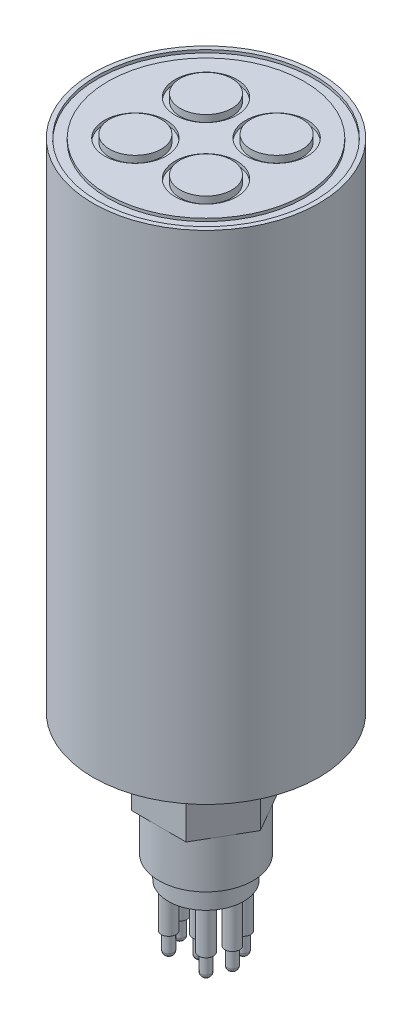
SolidWorks part; units mm, degrees
ref_plane "Front" through (0, 0, 0) normal (0, 0, 1) x (1, 0, 0)
ref_plane "Top" through (0, 0, 0) normal (0, 1, 0) x (1, 0, 0)
ref_plane "Right" through (0, 0, 0) normal (1, 0, 0) x (0, 0, -1)
sketch "Sketch1" plane through (0, 0, 0) normal (0, 1, 0) x (1, 0, 0)
  circle A0 centre (0, 0) radius 22.86
  dimension "D1" = 45.72
extrude "Boss-Extrude1" add sketch "Sketch1" along normal blind 100.584
sketch "Sketch2" plane through (0, 100.584, 0) normal (0, 1, 0) x (1, 0, 0)
  circle A0 centre (0, 0) radius 21.9456
  circle A2 centre (0, 0) radius 19.8628
extrude "Cut-Extrude1" cut sketch "Sketch2" against normal blind 0.5842
sketch "Sketch4" plane through (0, 100.584, 0) normal (0, 1, 0) x (1, 0, 0)
  line L0 (0, 0) -> (-16.4361, 0) construction
  line L1 (0, 0) -> (0, 17.578) construction
  circle A0 centre (-7.1437, 7.1437) radius 6.2547
  circle A1 centre (7.1437, 7.1437) radius 6.2547
  circle A2 centre (7.1437, -7.1437) radius 6.2547
  circle A3 centre (-7.1437, -7.1437) radius 6.2547
  dimension "D1" = 12.5095
  dimension "D3" = 13.3985
  dimension "D2" = 13.3985
extrude "Cut-Extrude4" cut sketch "Sketch4" against normal blind 0.7112
sketch "Sketch5" plane through (0, 99.8728, 0) normal (0, 1, 0) x (1, 0, 0)
  line L0 (0, 0) -> (0, 14.0298) construction
  line L1 (0, 0) -> (-15.5796, 0) construction
  circle A0 centre (-7.1437, 7.1437) radius 5.2324
  circle A1 centre (7.1437, 7.1437) radius 5.2324
  circle A2 centre (7.1437, -7.1437) radius 5.2324
  circle A3 centre (-7.1437, -7.1437) radius 5.2324
  dimension "D1" = 10.4648
extrude "Boss-Extrude2" add sketch "Sketch5" along normal blind 1.397
sketch "Sketch7" plane through (0, 0, 0) normal (0, -1, 0) x (1, 0, 0)
  line L1 (5.4993, 9.525) -> (-5.4993, 9.525)
  line L2 (-5.4993, 9.525) -> (-10.9985, 0)
  line L3 (-10.9985, 0) -> (-5.4993, -9.525)
  line L4 (-5.4993, -9.525) -> (5.4993, -9.525)
  line L5 (5.4993, -9.525) -> (10.9985, 0)
  line L6 (10.9985, 0) -> (5.4993, 9.525)
  circle A0 centre (0, 0) radius 9.525 construction
  dimension "D1" = 19.05
extrude "Boss-Extrude3" add sketch "Sketch7" along normal blind 15.24
sketch "Sketch8" plane through (0, -15.24, 0) normal (0, -1, 0) x (1, 0, 0)
  circle A0 centre (0, 0) radius 9.525
  dimension "D1" = 19.05
extrude "Boss-Extrude4" add sketch "Sketch8" along normal blind 9.525
sketch "Sketch9" plane through (0, -24.765, 0) normal (0, -1, 0) x (1, 0, 0)
  circle A0 centre (0, 0) radius 7.62
  dimension "D1" = 15.24
extrude "Boss-Extrude5" add sketch "Sketch9" along normal blind 4.572
sketch "Sketch10" plane through (0, -29.337, 0) normal (0, -1, 0) x (1, 0, 0)
  line L0 (0, 0) -> (3.7717, 3.7717) construction
  line L1 (0, 0) -> (0, 14.9678) construction
  circle A0 centre (3.7717, 3.7717) radius 1.4859
  dimension "D1" = 2.9718
  dimension "D2" = 5.334
  dimension "D3" = 45
extrude "Boss-Extrude6" add sketch "Sketch10" along normal blind 8.89
sketch "Sketch12" plane through (0, -38.227, 0) normal (0, -1, 0) x (1, 0, 0)
  circle A0 centre (3.7717, 3.7717) radius 1.016
  dimension "D1" = 2.032
extrude "Boss-Extrude7" add sketch "Sketch12" along normal blind 4.318
fillet "Fillet4" radius 0.9525 1 edges at (3.7717, -42.545, 2.7557)
pattern_circular "CirPattern1" count 7 every 45 about axis through (0, 0, 0) along (0, 1, 0) of "Boss-Extrude6", "Boss-Extrude7", "Fillet4"
pattern_linear "LPattern2" count 2 spacing 3.7719 along (-1, 0, 0) count 2 spacing 2.54 along (0, 0, -1) of "Boss-Extrude7", "Fillet4", "Boss-Extrude6"
ref_plane "Plane1" through (0, 0, -22.86) normal (0, 0, -1) x (-1, 0, 0)
hole_wizard "#6-32 Tapped Hole1" positions "3DSketch4" profile "Sketch16" tap size "#6-32" standard "ANSI Inch"
sketch3d "3DSketch4"
  circle A1 centre (0, 100.584, 0) radius 22.86 construction
  point P0 (0, 76.7567, -22.86)
  point P12 (0, 123.444, 0)
  dimension "D1" = 33.02
sketch "Sketch16" plane through (0, 76.7567, -22.86) normal (1, 0, 0) x (0, 1, 0)
  line L0 (0, 0) -> (0, 10.2107)
  line L1 (0, 10.2107) -> (1.3525, 9.398)
  line L2 (1.3525, 9.398) -> (1.3525, 7.112)
  line L3 (1.3525, 7.112) -> (1.7526, 7.112)
  line L4 (1.7526, 7.112) -> (1.7526, 0)
  line L5 (1.7526, 0) -> (0, 0)
  line L10 (0, 10.2107) -> (-1.3526, 9.398) construction
  line L11 (0, -6.35) -> (0, 107.95) construction
  dimension "Tap Drill Dia." = 2.7051
  dimension "Tap Drill Depth" = 9.398
  dimension "Thread Major Dia." = 3.5052
  dimension "Thread Depth" = 7.112
  dimension "Drill Angle" = 118
